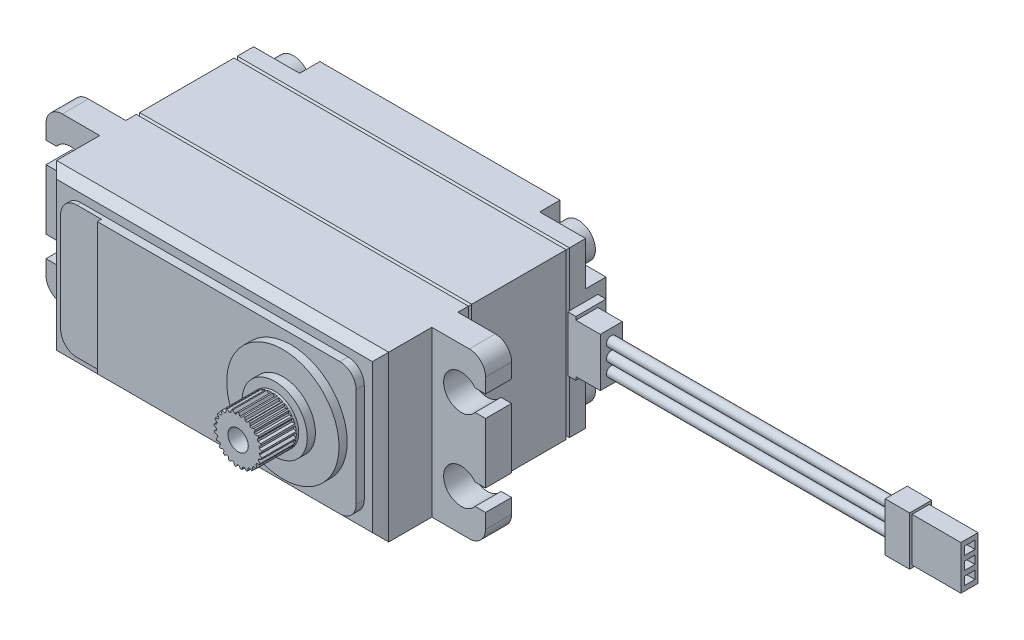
SolidWorks part; units mm, degrees
ref_plane "前视基准面" through (0, 0, 0) normal (0, 0, 1) x (1, 0, 0)
ref_plane "上视基准面" through (0, 0, 0) normal (0, 1, 0) x (1, 0, 0)
ref_plane "右视基准面" through (0, 0, 0) normal (1, 0, 0) x (0, 0, -1)
sketch "草图1" plane through (0, 0, 0) normal (0, 0, 1) x (1, 0, 0)
  line L1 (-20.4, 10.1) -> (20.4, 10.1)
  line L2 (-20.4, 10.1) -> (-20.4, -10.1)
  line L3 (-20.4, -10.1) -> (20.4, -10.1)
  line L4 (20.4, 10.1) -> (20.4, -10.1)
  dimension "D1" = 20.4
  dimension "D2" = 40.8
  dimension "D3" = 10.1
  dimension "D4" = 20.2
extrude "凸台-拉伸1" add sketch "草图1" along normal blind 4.7
chamfer "倒角1" distance 0.2 angle 45 4 edges at (0, -10.1, 4.7) (20.4, 0, 4.7) (-20.4, 0, 4.7) (0, 10.1, 4.7)
sketch "草图2" plane through (0, 0, 4.7) normal (0, 0, 1) x (1, 0, 0)
  line L0 (20.4, 10.1) -> (20.4, -10.1) construction
  line L1 (20.4, -10.1) -> (-20.4, -10.1) construction
  line L2 (-20.4, -10.1) -> (-20.4, 10.1) construction
  line L3 (-20.4, 10.1) -> (20.4, 10.1) construction
  line L16 (20.4, 10.1) -> (20.4, -10.1)
  line L17 (20.4, -10.1) -> (-20.4, -10.1)
  line L18 (-20.4, -10.1) -> (-20.4, 10.1)
  line L19 (-20.4, 10.1) -> (20.4, 10.1)
extrude "凸台-拉伸2" add sketch "草图2" along normal blind 12 separate body
chamfer "倒角5" distance 0.2 angle 45 4 edges at (0, -10.1, 16.7) (20.4, 0, 16.7) (-20.4, 0, 16.7) (0, 10.1, 16.7)
sketch "草图3" plane through (0, 0, 16.7) normal (0, 0, 1) x (1, 0, 0)
  line L0 (20.4, 10.1) -> (20.4, -10.1) construction
  line L1 (20.4, -10.1) -> (-20.4, -10.1) construction
  line L2 (-20.4, -10.1) -> (-20.4, 10.1) construction
  line L3 (-20.4, 10.1) -> (20.4, 10.1) construction
  line L24 (20.4, 10.1) -> (20.4, -10.1)
  line L25 (20.4, -10.1) -> (-20.4, -10.1)
  line L26 (-20.4, -10.1) -> (-20.4, 10.1)
  line L27 (-20.4, 10.1) -> (20.4, 10.1)
extrude "凸台-拉伸3" add sketch "草图3" along normal blind 11 separate body
chamfer "倒角6" distance 0.2 angle 45 4 edges at (0, 10.1, 16.7) (20.4, 0, 16.7) (-20.4, 0, 16.7) (0, -10.1, 16.7)
chamfer "倒角3" distance 1 angle 45 4 edges at (20.4, 0, 27.7) (0, -10.1, 27.7) (-20.4, 0, 27.7) (0, 10.1, 27.7)
chamfer "倒角4" distance 0.2 angle 45 4 edges at (0, 10.1, 4.7) (20.4, 0, 4.7) (0, -10.1, 4.7) (-20.4, 0, 4.7)
sketch "草图4" plane through (0, 0, 27.7) normal (0, 0, 1) x (1, 0, 0)
  line L0 (20.4, 10.1) -> (20.4, -10.1) construction
  circle A0 centre (10.4, 0) radius 6.9
  dimension "D1" = 10
  dimension "D2" = 13.8
extrude "凸台-拉伸4" add sketch "草图4" along normal blind 2
sketch "草图5" plane through (0, 0, 29.7) normal (0, 0, 1) x (1, 0, 0)
  circle A0 centre (10.4, 0) radius 4
  dimension "D1" = 8
extrude "凸台-拉伸5" add sketch "草图5" along normal blind 1
sketch "草图6" plane through (0, 0, 30.7) normal (0, 0, 1) x (1, 0, 0)
  circle A0 centre (10.4, 0) radius 2.95
  dimension "D1" = 5.9
extrude "凸台-拉伸6" add sketch "草图6" along normal blind 4.5
sketch "草图7" plane through (0, 0, 35.2) normal (0, 0, 1) x (1, 0, 0)
  circle A0 centre (10.4, 0) radius 1.25
  dimension "D1" = 2.5
extrude "切除-拉伸1" cut sketch "草图7" against normal blind 5
sketch "草图8" plane through (0, 0, 35.2) normal (0, 0, 1) x (1, 0, 0)
  line L0 (11.0364, 2.8805) -> (10.8129, 2.6133)
  line L1 (10.3, 2.9483) -> (10.15, 2.6339)
  line L2 (10.4752, 2.949) -> (10.624, 2.6372)
  line L3 (11.7327, 2.6318) -> (11.4498, 2.4286)
  line L4 (11.2062, 2.8377) -> (11.2728, 2.4987)
  line L5 (12.3454, 2.2177) -> (12.0208, 2.0912)
  line L6 (11.8866, 2.548) -> (11.8667, 2.2031)
  line L7 (12.8358, 1.6642) -> (12.4899, 1.6224)
  line L8 (12.4736, 2.0983) -> (12.3686, 1.7691)
  line L9 (13.1731, 1.0062) -> (12.8277, 1.0517)
  line L10 (12.9302, 1.5167) -> (12.7467, 1.224)
  line L11 (13.3362, 0.2849) -> (13.013, 0.4149)
  line L12 (13.2279, 0.8398) -> (12.9773, 0.6019)
  line L13 (13.3148, -0.4542) -> (13.0341, -0.248)
  line L14 (13.3479, 0.1101) -> (13.0461, -0.0579)
  line L15 (13.1103, -1.1648) -> (12.8897, -0.8953)
  line L16 (13.2827, -0.6264) -> (12.9485, -0.7142)
  line L17 (12.7355, -1.8023) -> (12.5888, -1.4863)
  line L18 (13.0364, -1.3237) -> (12.6909, -1.3255)
  line L19 (12.2139, -2.3264) -> (12.1504, -1.9839)
  line L20 (12.6244, -1.9377) -> (12.2892, -1.8536)
  line L21 (11.5783, -2.7045) -> (11.6021, -2.3569)
  line L22 (12.0726, -2.43) -> (11.7689, -2.2652)
  line L23 (10.8687, -2.9125) -> (10.9781, -2.5818)
  line L24 (11.4157, -2.7696) -> (11.1626, -2.5345)
  line L25 (10.1297, -2.9376) -> (10.3179, -2.6445)
  line L26 (10.695, -2.9352) -> (10.5083, -2.6445)
  line L27 (9.4076, -2.7781) -> (9.6628, -2.541)
  line L28 (9.9558, -2.9164) -> (9.8473, -2.5883)
  line L29 (8.7479, -2.444) -> (9.0541, -2.2778)
  line L30 (9.2445, -2.7143) -> (9.2209, -2.3696)
  line L31 (8.192, -1.9564) -> (8.5299, -1.8716)
  line L32 (8.6058, -2.3416) -> (8.6687, -2.0019)
  line L33 (7.7749, -1.3458) -> (8.1232, -1.3477)
  line L34 (8.0798, -1.8219) -> (8.2252, -1.5085)
  line L35 (7.5227, -0.6507) -> (7.8596, -0.7391)
  line L36 (7.6996, -1.1876) -> (7.9184, -0.9202)
  line L37 (7.4512, 0.0853) -> (7.7556, -0.0841)
  line L38 (7.4891, -0.4787) -> (7.7675, -0.2742)
  line L39 (7.5651, 0.816) -> (7.8177, 0.5762)
  line L40 (7.4615, 0.2602) -> (7.7821, 0.3891)
  line L41 (7.8571, 1.4953) -> (8.0422, 1.2002)
  line L42 (7.6185, 0.9828) -> (7.9611, 1.0279)
  line L43 (8.3088, 2.0808) -> (8.4147, 1.7489)
  line L44 (7.9503, 1.6437) -> (8.2933, 1.6022)
  line L45 (8.892, 2.5354) -> (8.912, 2.1877)
  line L46 (8.436, 2.2012) -> (8.758, 2.0758)
  line L47 (9.5699, 2.8308) -> (9.5028, 2.489)
  line L48 (9.0452, 2.6205) -> (9.3258, 2.4189)
  line L49 (9.7394, 2.8751) -> (9.9611, 2.6101)
  circle A0 centre (10.4, 0) radius 2.95 construction
  arc A1 (11.0364, 2.8805) -> (10.4752, 2.949) centre (10.4, 0) ccw
  arc A2 (10.15, 2.6339) -> (9.9611, 2.6101) centre (10.4, -0.1047) ccw
  arc A3 (10.3, 2.9483) -> (9.7394, 2.8751) centre (10.4, 0) ccw
  arc A4 (10.8129, 2.6133) -> (10.624, 2.6372) centre (10.374, -0.1014) ccw
  arc A5 (11.7327, 2.6318) -> (11.2062, 2.8377) centre (10.4, 0) ccw
  arc A6 (11.4498, 2.4286) -> (11.2728, 2.4987) centre (10.3496, -0.0917) ccw
  arc A7 (12.3454, 2.2177) -> (11.8866, 2.548) centre (10.4, 0) ccw
  arc A8 (12.0208, 2.0912) -> (11.8667, 2.2031) centre (10.3283, -0.0763) ccw
  arc A9 (12.8358, 1.6642) -> (12.4736, 2.0983) centre (10.4, 0) ccw
  arc A10 (12.4899, 1.6224) -> (12.3686, 1.7691) centre (10.3116, -0.0561) ccw
  arc A11 (13.1731, 1.0062) -> (12.9302, 1.5167) centre (10.4, 0) ccw
  arc A12 (12.8277, 1.0517) -> (12.7467, 1.224) centre (10.3004, -0.0324) ccw
  arc A13 (13.3362, 0.2849) -> (13.2279, 0.8398) centre (10.4, 0) ccw
  arc A14 (13.013, 0.4149) -> (12.9773, 0.6019) centre (10.2955, -0.0066) ccw
  arc A15 (13.3148, -0.4542) -> (13.3479, 0.1101) centre (10.4, 0) ccw
  arc A16 (13.0341, -0.248) -> (13.0461, -0.0579) centre (10.2972, 0.0196) ccw
  arc A17 (13.1103, -1.1648) -> (13.2827, -0.6264) centre (10.4, 0) ccw
  arc A18 (12.8897, -0.8953) -> (12.9485, -0.7142) centre (10.3053, 0.0446) ccw
  arc A19 (12.7355, -1.8023) -> (13.0364, -1.3237) centre (10.4, 0) ccw
  arc A20 (12.5888, -1.4863) -> (12.6909, -1.3255) centre (10.3193, 0.0667) ccw
  arc A21 (12.2139, -2.3264) -> (12.6244, -1.9377) centre (10.4, 0) ccw
  arc A22 (12.1504, -1.9839) -> (12.2892, -1.8536) centre (10.3385, 0.0847) ccw
  arc A23 (11.5783, -2.7045) -> (12.0726, -2.43) centre (10.4, 0) ccw
  arc A24 (11.6021, -2.3569) -> (11.7689, -2.2652) centre (10.3615, 0.0973) ccw
  arc A25 (10.8687, -2.9125) -> (11.4157, -2.7696) centre (10.4, 0) ccw
  arc A26 (10.9781, -2.5818) -> (11.1626, -2.5345) centre (10.3869, 0.1039) ccw
  arc A27 (10.1297, -2.9376) -> (10.695, -2.9352) centre (10.4, 0) ccw
  arc A28 (10.3179, -2.6445) -> (10.5083, -2.6445) centre (10.4131, 0.1039) ccw
  arc A29 (9.4076, -2.7781) -> (9.9558, -2.9164) centre (10.4, 0) ccw
  arc A30 (9.6628, -2.541) -> (9.8473, -2.5883) centre (10.4385, 0.0973) ccw
  arc A31 (8.7479, -2.444) -> (9.2445, -2.7143) centre (10.4, 0) ccw
  arc A32 (9.0541, -2.2778) -> (9.2209, -2.3696) centre (10.4615, 0.0847) ccw
  arc A33 (8.192, -1.9564) -> (8.6058, -2.3416) centre (10.4, 0) ccw
  arc A34 (8.5299, -1.8716) -> (8.6687, -2.0019) centre (10.4807, 0.0667) ccw
  arc A35 (7.7749, -1.3458) -> (8.0798, -1.8219) centre (10.4, 0) ccw
  arc A36 (8.1232, -1.3477) -> (8.2252, -1.5085) centre (10.4947, 0.0446) ccw
  arc A37 (7.5227, -0.6507) -> (7.6996, -1.1876) centre (10.4, 0) ccw
  arc A38 (7.8596, -0.7391) -> (7.9184, -0.9202) centre (10.5028, 0.0196) ccw
  arc A39 (7.4512, 0.0853) -> (7.4891, -0.4787) centre (10.4, 0) ccw
  arc A40 (7.7556, -0.0841) -> (7.7675, -0.2742) centre (10.5045, -0.0066) ccw
  arc A41 (7.5651, 0.816) -> (7.4615, 0.2602) centre (10.4, 0) ccw
  arc A42 (7.8177, 0.5762) -> (7.7821, 0.3891) centre (10.4996, -0.0324) ccw
  arc A43 (7.8571, 1.4953) -> (7.6185, 0.9828) centre (10.4, 0) ccw
  arc A44 (8.0422, 1.2002) -> (7.9611, 1.0279) centre (10.4884, -0.0561) ccw
  arc A45 (8.3088, 2.0808) -> (7.9503, 1.6437) centre (10.4, 0) ccw
  arc A46 (8.4147, 1.7489) -> (8.2933, 1.6022) centre (10.4717, -0.0763) ccw
  arc A47 (8.892, 2.5354) -> (8.436, 2.2012) centre (10.4, 0) ccw
  arc A48 (8.912, 2.1877) -> (8.758, 2.0758) centre (10.4504, -0.0917) ccw
  arc A49 (9.5699, 2.8308) -> (9.0452, 2.6205) centre (10.4, 0) ccw
  arc A50 (9.5028, 2.489) -> (9.3258, 2.4189) centre (10.426, -0.1014) ccw
  point P147 (10.4, 0)
extrude "切除-拉伸2" cut sketch "草图8" against normal blind 4.2
ref_plane "基准面1" through (0, 0, 18.2) normal (0, 0, 1) x (1, 0, 0)
sketch "草图9" plane through (0, 0, 18.2) normal (0, 0, 1) x (1, 0, 0)
  line L0 (20.4, -10.1) -> (27, -10.1)
  line L1 (-20.4, -10.1) -> (-20.4, 10.1) construction
  line L4 (-27, 10.1) -> (-27, 6.3)
  line L5 (27, -6.3) -> (27, -10.1)
  line L6 (-20.4, 10.1) -> (-27, 10.1)
  line L7 (-20.4, -10.1) -> (-27, -10.1)
  line L8 (27, -6.3) -> (25.7125, -6.3)
  line L9 (27, -3.7) -> (25.7125, -3.7)
  line L10 (-27, -3.7) -> (-25.7125, -3.7)
  line L11 (-27, 3.7) -> (-25.7125, 3.7)
  line L12 (-27, 6.3) -> (-25.7125, 6.3)
  line L13 (-20.4, -10.1) -> (-20.4, 10.1)
  line L14 (-27, 3.7) -> (-27, -3.7)
  line L15 (-27, -6.3) -> (-25.7125, -6.3)
  line L16 (-27, -6.3) -> (-27, -10.1)
  line L18 (27, 3.7) -> (27, -3.7)
  line L19 (27, 3.7) -> (25.7125, 3.7)
  line L20 (27, 6.3) -> (25.7125, 6.3)
  line L21 (27, 10.1) -> (27, 6.3)
  line L22 (20.4, -10.1) -> (20.4, 10.1)
  line L23 (20.4, 10.1) -> (27, 10.1)
  arc A0 (-25.7125, 3.7) -> (-25.7125, 6.3) centre (-24, 5) ccw
  arc A1 (-25.7125, -6.3) -> (-25.7125, -3.7) centre (-24, -5) ccw
  arc A4 (25.7125, -6.3) -> (25.7125, -3.7) centre (24, -5) cw
  arc A5 (25.7125, 3.7) -> (25.7125, 6.3) centre (24, 5) cw
  point P18 (-27, -12.7272)
  point P35 (-27.462, 3.7)
  point P36 (-19.7917, 3.7)
  point P37 (-27.462, 6.3)
  point P38 (-19.7917, 6.3)
  dimension "D1" = 4.3
  dimension "D2" = 4.3
  dimension "D3" = 10
extrude "凸台-拉伸7" add sketch "草图9" along normal blind 3.2
fillet "圆角1" radius 2 4 edges at (27, 10.1, 19.8) (27, -10.1, 19.8) (-27, -10.1, 19.8) (-27, 10.1, 19.8)
sketch "草图10" plane through (0, 0, 27.7) normal (0, 0, 1) x (1, 0, 0)
  line L18 (-18.4, 8.1) -> (-18.4, -8.1)
  line L19 (-18.4, -8.1) -> (18.4, -8.1)
  line L20 (18.4, -8.1) -> (18.4, 8.1)
  line L21 (18.4, 8.1) -> (-18.4, 8.1)
  line L22 (-18.4, 8.1) -> (-18.4, -8.1)
  line L23 (-18.4, -8.1) -> (18.4, -8.1)
  line L24 (18.4, -8.1) -> (18.4, 8.1)
  line L25 (18.4, 8.1) -> (-18.4, 8.1)
  circle A0 centre (10.4, 0) radius 6.9 construction
  circle A1 centre (10.4, 0) radius 6.9
  dimension "D1" = 2
extrude "凸台-拉伸8" add sketch "草图10" along normal blind 1
sketch "草图11" plane through (0, 0, 28.7) normal (0, 0, 1) x (1, 0, 0)
  line L0 (-18.4, -8.1) -> (18.4, -8.1) construction
  line L1 (-18.4, 8.1) -> (-13.4, 8.1)
  line L2 (-18.4, 8.1) -> (-18.4, -8.1)
  line L3 (-18.4, -8.1) -> (-13.4, -8.1)
  line L4 (-13.4, 8.1) -> (-13.4, -8.1)
  dimension "D1" = 5
extrude "切除-拉伸3" cut sketch "草图11" against normal blind 0.5
fillet "圆角2" radius 2 4 edges at (-18.4, 8.1, 27.95) (18.4, 8.1, 28.2) (18.4, -8.1, 28.2) (-18.4, -8.1, 27.95)
sketch "草图12" plane through (20.4, 0, 0) normal (1, 0, 0) x (0, 0, -1)
  line L0 (-1, 3.4) -> (-4.7, 3.4)
  line L5 (-1, -3.4) -> (-4.7, -3.4)
  line L7 (-4.7, 3.4) -> (-4.7, -3.4)
  line L10 (-1, 9.9) -> (-1, -9.9)
  line L11 (-1, 3.4) -> (-1, -3.4)
  point P1 (0, 3.4)
  point P2 (-10.5775, 3.4)
  point P6 (0, -3.4)
  point P7 (-10.5775, -3.4)
  dimension "D4" = 3.7
extrude "凸台-拉伸9" add sketch "草图12" along normal blind 1
sketch "草图13" plane through (21.4, 0, 0) normal (1, 0, 0) x (0, 0, -1)
  line L1 (-2, 3) -> (-4.7, 3)
  line L2 (-2, -3) -> (-4.7, -3)
  line L4 (-4.7, 3.4) -> (-4.7, -3.4) construction
  line L7 (-2, -3.4) -> (-2, 3.4)
  line L8 (-2, -3) -> (-2, 3)
  line L9 (-4.7, 3) -> (-4.7, -3)
  point P3 (0, 3)
  point P4 (-6.4222, 3)
  point P5 (0, -3)
  point P6 (-6.4222, -3)
  dimension "D4" = 1
extrude "凸台-拉伸10" add sketch "草图13" along normal blind 3
sketch "草图14" plane through (24.4, 0, 0) normal (1, 0, 0) x (0, 0, -1)
  line L0 (-2, 3) -> (-4.7, 3) construction
  circle A0 centre (-3.35, 1.6) radius 0.6
  circle A1 centre (-3.35, 0) radius 0.6
  circle A2 centre (-3.35, -1.6) radius 0.6
  dimension "D1" = 1.2
  dimension "D2" = 1.2
  dimension "D3" = 1.2
  dimension "D4" = 1.4
  dimension "D5" = 1.6
  dimension "D6" = 1.6
extrude "凸台-拉伸11" add sketch "草图14" along normal blind 35
sketch "草图15" plane through (59.4, 0, 0) normal (1, 0, 0) x (0, 0, -1)
  line L0 (-2, -3) -> (-2, 3) construction
  line L1 (-4.7, 3) -> (-2, 3)
  line L2 (-4.7, 3) -> (-4.7, -3)
  line L3 (-4.7, -3) -> (-2, -3)
  line L4 (-2, 3) -> (-2, -3)
  line L5 (-2, -3) -> (-2, 3) construction
extrude "凸台-拉伸12" add sketch "草图15" along normal blind 3
sketch "草图16" plane through (62.4, 0, 0) normal (1, 0, 0) x (0, 0, -1)
  line L13 (-2.3, 2.7) -> (-4.4, 2.7)
  line L14 (-4.4, -2.7) -> (-4.4, 2.7)
  line L15 (-4.4, -2.7) -> (-2.3, -2.7)
  line L16 (-2.3, -2.7) -> (-2.3, 2.7)
  line L18 (-3.9665, 2.1) -> (-2.6663, 2.1)
  line L19 (-3.9665, 2.1) -> (-3.9665, 1.1)
  line L20 (-3.9665, 1.1) -> (-2.6663, 1.1)
  line L21 (-2.6663, 2.1) -> (-2.6663, 1.1)
  line L22 (-3.9665, 0.5) -> (-2.6663, 0.5)
  line L23 (-3.9665, 0.5) -> (-3.9665, -0.5)
  line L24 (-3.9665, -0.5) -> (-2.6663, -0.5)
  line L25 (-2.6663, 0.5) -> (-2.6663, -0.5)
  line L26 (-3.9665, -1.1) -> (-2.6663, -1.1)
  line L27 (-3.9665, -1.1) -> (-3.9665, -2.1)
  line L28 (-3.9665, -2.1) -> (-2.6663, -2.1)
  line L29 (-2.6663, -1.1) -> (-2.6663, -2.1)
  dimension "D1" = 0.6
  dimension "D2" = 1
  dimension "D3" = 0.6
  dimension "D4" = 1
  dimension "D5" = 0.6
  dimension "D6" = 1
extrude "凸台-拉伸13" add sketch "草图16" along normal blind 6
sketch "草图17" plane through (0, 0, 0) normal (0, 0, -1) x (-1, 0, 0)
  line L0 (-14.75, 7.5) -> (-14.75, 10.1)
  line L1 (-17.5, 4.75) -> (-20.4, 4.75)
  line L2 (-17.5, -4.75) -> (-20.4, -4.75)
  line L3 (-14.75, -7.5) -> (-14.75, -10.1)
  line L4 (17.5, -4.75) -> (20.4, -4.75)
  line L5 (14.75, -7.5) -> (14.75, -10.1)
  line L6 (14.75, 7.5) -> (14.75, 10.1)
  line L7 (17.5, 4.75) -> (20.4, 4.75)
  line L8 (-20.4, 10.1) -> (20.4, 10.1) construction
  line L9 (-20.4, 10.1) -> (-14.75, 10.1)
  line L10 (20.4, -10.1) -> (20.4, 10.1) construction
  line L11 (20.4, -10.1) -> (20.4, -4.75)
  line L12 (-20.4, -10.1) -> (-20.4, 10.1) construction
  line L13 (-20.4, -10.1) -> (-20.4, -4.75)
  line L14 (20.4, -10.1) -> (-20.4, -10.1) construction
  line L15 (20.4, -10.1) -> (14.75, -10.1)
  line L16 (14.75, 10.1) -> (20.4, 10.1)
  line L17 (-20.4, 4.75) -> (-20.4, 10.1)
  line L18 (-14.75, -10.1) -> (-20.4, -10.1)
  line L19 (20.4, 4.75) -> (20.4, 10.1)
  circle A0 centre (-17.5, 7.5) radius 1
  circle A1 centre (-17.5, -7.5) radius 1
  circle A2 centre (17.5, 7.5) radius 1
  circle A3 centre (17.5, -7.5) radius 1
  arc A4 (-17.5, 4.75) -> (-14.75, 7.5) centre (-17.5, 7.5) ccw
  arc A5 (14.75, 7.5) -> (17.5, 4.75) centre (17.5, 7.5) ccw
  arc A6 (17.5, -4.75) -> (14.75, -7.5) centre (17.5, -7.5) ccw
  arc A7 (-14.75, -7.5) -> (-17.5, -4.75) centre (-17.5, -7.5) ccw
  dimension "D2" = 5.5
  dimension "D3" = 5.5
  dimension "D4" = 5.5
  dimension "D5" = 15
  dimension "D6" = 5.5
  dimension "D9" = 2
  dimension "D10" = 2
  dimension "D11" = 2
  dimension "D12" = 2
extrude "切除-拉伸4" cut sketch "草图17" against normal blind 2.5
sketch "草图18" plane through (0, 0, 0) normal (0, 0, -1) x (-1, 0, 0)
  circle A1 centre (-17.5, -7.5) radius 1
  circle A2 centre (-17.5, -7.5) radius 1
  circle A3 centre (-17.5, 7.5) radius 1
  circle A4 centre (-17.5, 7.5) radius 1
  circle A5 centre (17.5, 7.5) radius 1
  circle A6 centre (17.5, 7.5) radius 1
  circle A7 centre (17.5, -7.5) radius 1
  circle A8 centre (17.5, -7.5) radius 1
  dimension "D1" = 0
  dimension "D2" = 0
  dimension "D3" = 0
  dimension "D4" = 0
extrude "切除-拉伸5" cut sketch "草图18" against normal blind 2.5
sketch "草图19" plane through (0, 0, 2.5) normal (0, 0, -1) x (-1, 0, 0)
  line L3 (-17, -7) -> (-15.8229, -7)
  line L4 (-17, -7) -> (-17, -5.8229)
  line L5 (-18, -7) -> (-18, -5.8229)
  line L6 (-18, 7) -> (-18, 5.8229)
  line L7 (-17, 8) -> (-15.8229, 8)
  line L8 (-19.1771, -7) -> (-18, -7)
  line L9 (-17, 7) -> (-17, 5.8229)
  line L10 (-19.1771, -8) -> (-18, -8)
  line L11 (-17, 7) -> (-15.8229, 7)
  line L12 (-18, -9.1771) -> (-18, -8)
  line L13 (-19.1771, 7) -> (-18, 7)
  line L14 (-17, -9.1771) -> (-17, -8)
  line L15 (-19.1771, 8) -> (-18, 8)
  line L16 (-17, 9.1771) -> (-17, 8)
  line L17 (-18, 9.1771) -> (-18, 8)
  line L18 (-17, -8) -> (-15.8229, -8)
  line L19 (17, 8) -> (15.8229, 8)
  line L20 (17, 7) -> (15.8229, 7)
  line L21 (17, 7) -> (17, 5.8229)
  line L22 (18, 7) -> (18, 5.8229)
  line L23 (19.1771, 7) -> (18, 7)
  line L24 (19.1771, 8) -> (18, 8)
  line L25 (18, 9.1771) -> (18, 8)
  line L26 (17, 9.1771) -> (17, 8)
  line L27 (17, -8) -> (15.8229, -8)
  line L28 (17, -9.1771) -> (17, -8)
  line L29 (18, -9.1771) -> (18, -8)
  line L30 (19.1771, -8) -> (18, -8)
  line L31 (19.1771, -7) -> (18, -7)
  line L32 (18, -7) -> (18, -5.8229)
  line L33 (17, -7) -> (17, -5.8229)
  line L34 (17, -7) -> (15.8229, -7)
  circle A0 centre (-17.5, 7.5) radius 2.1
  arc A1 (-18, 5.8229) -> (-17, 5.8229) centre (-17.5, 7.5) ccw
  arc A2 (-19.1771, 8) -> (-19.1771, 7) centre (-17.5, 7.5) ccw
  arc A3 (-17, 9.1771) -> (-18, 9.1771) centre (-17.5, 7.5) ccw
  arc A4 (-15.8229, 7) -> (-15.8229, 8) centre (-17.5, 7.5) ccw
  arc A5 (-18, -5.8229) -> (-17, -5.8229) centre (-17.5, -7.5) cw
  arc A6 (-19.1771, -8) -> (-19.1771, -7) centre (-17.5, -7.5) cw
  arc A7 (-17, -9.1771) -> (-18, -9.1771) centre (-17.5, -7.5) cw
  arc A8 (-15.8229, -7) -> (-15.8229, -8) centre (-17.5, -7.5) cw
  circle A9 centre (-17.5, -7.5) radius 2.1
  arc A10 (15.8229, 7) -> (15.8229, 8) centre (17.5, 7.5) cw
  arc A11 (18, 5.8229) -> (17, 5.8229) centre (17.5, 7.5) cw
  arc A12 (19.1771, 8) -> (19.1771, 7) centre (17.5, 7.5) cw
  arc A13 (17, 9.1771) -> (18, 9.1771) centre (17.5, 7.5) cw
  circle A14 centre (17.5, 7.5) radius 2.1
  arc A15 (17, -9.1771) -> (18, -9.1771) centre (17.5, -7.5) ccw
  arc A16 (19.1771, -8) -> (19.1771, -7) centre (17.5, -7.5) ccw
  arc A17 (18, -5.8229) -> (17, -5.8229) centre (17.5, -7.5) ccw
  arc A18 (15.8229, -7) -> (15.8229, -8) centre (17.5, -7.5) ccw
  circle A19 centre (17.5, -7.5) radius 2.1
  point P9 (-19.6, 7)
  point P10 (-14.75, 7)
  point P11 (-18, 9.6)
  point P12 (-18, 5.4)
  point P13 (-19.6, 8)
  point P14 (-14.75, 8)
  point P15 (-17, 9.6)
  point P16 (-17, 5.4)
  dimension "D1" = 4.2
  dimension "D2" = 3.5
extrude "凸台-拉伸14" add sketch "草图19" along normal blind 2
